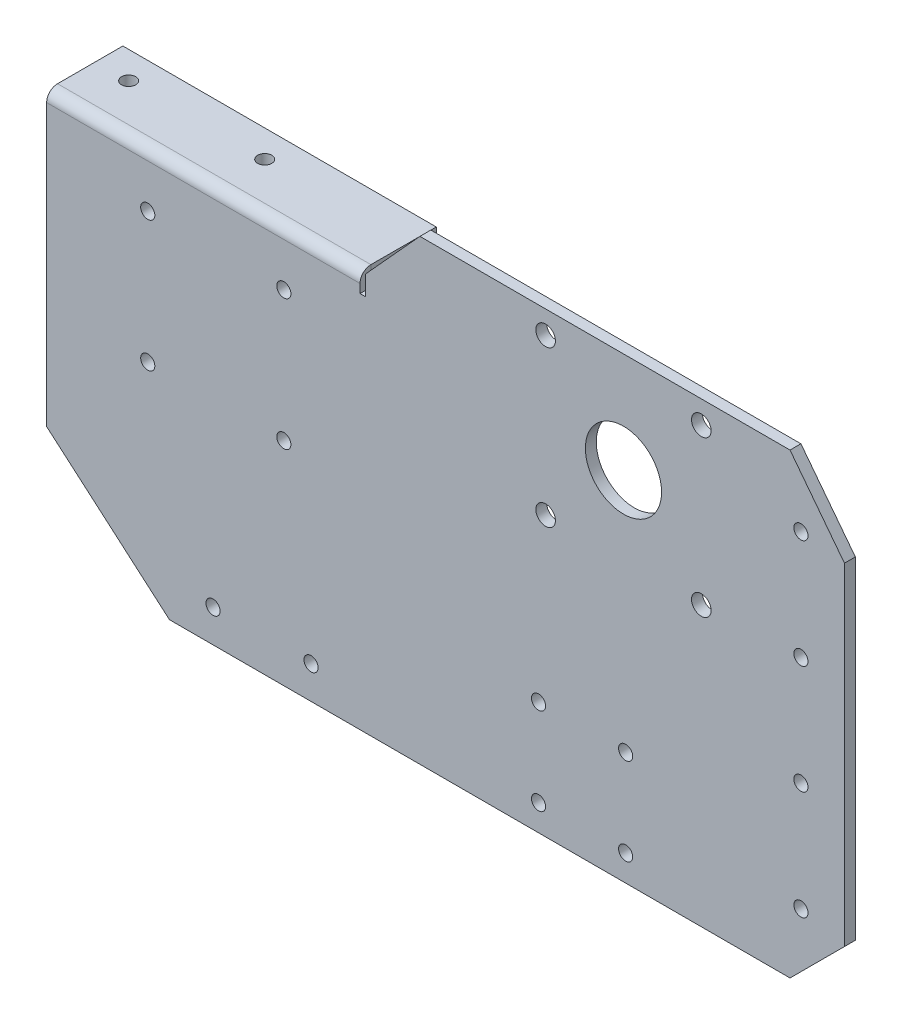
SolidWorks part; units mm, degrees
ref_plane "Front" through (0, 0, 0) normal (0, 0, 1) x (1, 0, 0)
ref_plane "Top" through (0, 0, 0) normal (0, 1, 0) x (1, 0, 0)
ref_plane "Right" through (0, 0, 0) normal (1, 0, 0) x (0, 0, -1)
sketch "Esquisse1" plane through (0, 0, 0) normal (0, 0, 1) x (1, 0, 0)
  line L0 (749.999, -0.001) -> (179.999, -0.001)
  line L1 (-0.001, 154.999) -> (-0.001, 364.999)
  line L2 (-0.001, 364.999) -> (354.999, 364.999)
  line L3 (354.999, 364.999) -> (354.999, 346.999)
  line L4 (354.999, 346.999) -> (359.999, 346.999)
  line L5 (359.999, 346.999) -> (359.999, 364.999)
  line L6 (359.999, 364.999) -> (409.999, 419.999)
  line L7 (409.999, 419.999) -> (749.999, 419.999)
  line L8 (799.999, 354.999) -> (799.999, 49.999)
  line L9 (179.999, -0.001) -> (-0.001, 154.999)
  line L10 (799.999, 49.999) -> (749.999, -0.001)
  line L11 (749.999, 419.999) -> (799.999, 354.999)
  line L12 (759.999, 365.8282) -> (759.999, 343.1853) construction
  line L13 (764.9957, 359.999) -> (744.5185, 359.999) construction
  line L14 (759.999, 265.8282) -> (759.999, 243.1853) construction
  line L15 (764.9957, 259.999) -> (744.5185, 259.999) construction
  line L16 (759.999, 165.8282) -> (759.999, 143.1853) construction
  line L17 (764.9957, 159.999) -> (744.5185, 159.999) construction
  line L18 (759.999, 65.8282) -> (759.999, 43.1853) construction
  line L19 (764.9957, 59.999) -> (744.5185, 59.999) construction
  circle A0 centre (759.999, 359.999) radius 6.5
  circle A1 centre (668.499, 398.999) radius 9
  circle A2 centre (668.499, 255.999) radius 9
  circle A3 centre (525.499, 398.999) radius 9
  circle A4 centre (525.499, 255.999) radius 9
  circle A5 centre (759.999, 259.999) radius 6.5
  circle A6 centre (596.999, 327.499) radius 35
  circle A7 centre (598.999, 103.999) radius 6.5
  circle A8 centre (598.999, 23.999) radius 6.5
  circle A9 centre (518.999, 103.999) radius 6.5
  circle A10 centre (518.999, 23.999) radius 6.5
  circle A11 centre (309.999, 29.999) radius 6.5
  circle A12 centre (219.999, 29.999) radius 6.5
  circle A13 centre (34.999, 194.999) radius 6.5
  circle A14 centre (159.999, 194.999) radius 6.5
  circle A15 centre (284.999, 194.999) radius 6.5
  circle A16 centre (34.999, 314.999) radius 6.5
  circle A17 centre (159.999, 314.999) radius 6.5
  circle A18 centre (284.999, 314.999) radius 6.5
  circle A19 centre (759.999, 159.999) radius 6.5
  circle A20 centre (759.999, 59.999) radius 6.5
  point P1 (-0.001, -0.001)
  point P9 (799.999, 419.999)
  point P10 (799.999, -0.001)
  dimension "D14" = 13
  dimension "D17" = 18
  dimension "D18" = 18
  dimension "D19" = 18
  dimension "D20" = 18
  dimension "D31" = 40
  dimension "D34" = 70
  dimension "D37" = 13
  dimension "D38" = 13
  dimension "D39" = 13
  dimension "D40" = 13
  dimension "D49" = 13
  dimension "D50" = 13
  dimension "D59" = 13
  dimension "D60" = 13
  dimension "D61" = 13
  dimension "D64" = 13
  dimension "D65" = 13
  dimension "D66" = 13
  dimension "D1" = 800
  dimension "D2" = 365
  dimension "D3" = 18
  dimension "D4" = 18
  dimension "D5" = 5
  dimension "D6" = 50
  dimension "D7" = 440
  dimension "D8" = 420
  dimension "D9" = 180
  dimension "D10" = 155
  dimension "D13" = 50
  dimension "D11" = 65
  dimension "D12" = 50
  dimension "D15" = 60
  dimension "D16" = 40
  dimension "D21" = 143
  dimension "D22" = 131.5
  dimension "D23" = 143
  dimension "D24" = 131.5
  dimension "D25" = 21
  dimension "D26" = 21
  dimension "D27" = 143
  dimension "D28" = 143
  dimension "D29" = 0.001
  dimension "D30" = 0.001
  dimension "D32" = 50
  dimension "D35" = 203
  dimension "D36" = 92.5
  dimension "D41" = 80
  dimension "D42" = 80
  dimension "D43" = 24
  dimension "D44" = 201
  dimension "D45" = 24
  dimension "D46" = 80
  dimension "D47" = 80
  dimension "D48" = 201
  dimension "D51" = 90
  dimension "D52" = 30
  dimension "D53" = 30
  dimension "D54" = 209
  dimension "D55" = 35
  dimension "D56" = 125
  dimension "D57" = 125
  dimension "D67" = 120
  dimension "D69" = 120
  dimension "D71" = 120
extrude "Base-Extrusion" add sketch "Esquisse1" along normal blind 10
sketch "Esquisse2" plane through (0, 364.999, 0) normal (0, 1, 0) x (-1, 0, 0)
  line L1 (-354.9618, 10) -> (0.0651, 10)
  line L2 (-354.9618, 10) -> (-355.0742, -60)
  line L3 (-355.0742, -60) -> (0.0651, -60)
  line L4 (0.0651, 10) -> (0.0651, -60)
  line L5 (-354.999, 10) -> (0.001, 10) construction
  dimension "D1" = 355.1393
  dimension "D2" = 70
extrude "Boss.-Extru.1" add sketch "Esquisse2" against normal blind 10
sketch "Esquisse3" plane through (0, 364.999, 0) normal (0, 1, 0) x (-1, 0, 0)
  line L0 (0.0651, -60) -> (0.0651, 10) construction
  line L1 (-355.0742, -60) -> (0.0651, -60) construction
  circle A0 centre (-97.4349, -35) radius 6.5
  circle A1 centre (-222.4349, -35) radius 6.5
  dimension "D1" = 13
  dimension "D2" = 13
  dimension "D3" = 97.5
  dimension "D4" = 125
  dimension "D5" = 25
extrude "Enlèv. mat.-Extru.1" cut sketch "Esquisse3" against normal through all
fillet "Congé1" radius 10
ref_plane "Plan1" through (67.1428, 349.999, -1560) normal (0, -1, 0) x (1, 0, 0)
sketch "Esquisse6" plane through (0, 0, 0) normal (0, 0, -1) x (-1, 0, 0)
  line L0 (-67.1428, 97.1807) -> (-67.1428, 459.3031)
  line L1 (-67.1428, 349.999) -> (-67.1428, 97.1807) construction
  line L2 (0.001, 154.999) -> (-179.999, -0.001) construction
  line L3 (-67.1428, 97.1807) -> (26.4631, 111.8416)
  line L4 (26.4631, 111.8416) -> (26.4631, 436.7407)
  line L5 (26.4631, 436.7407) -> (-64.499, 459.3031)
extrude "Enlèv. mat.-Extru.2" cut sketch "Esquisse6" against normal through all and the other way through all
